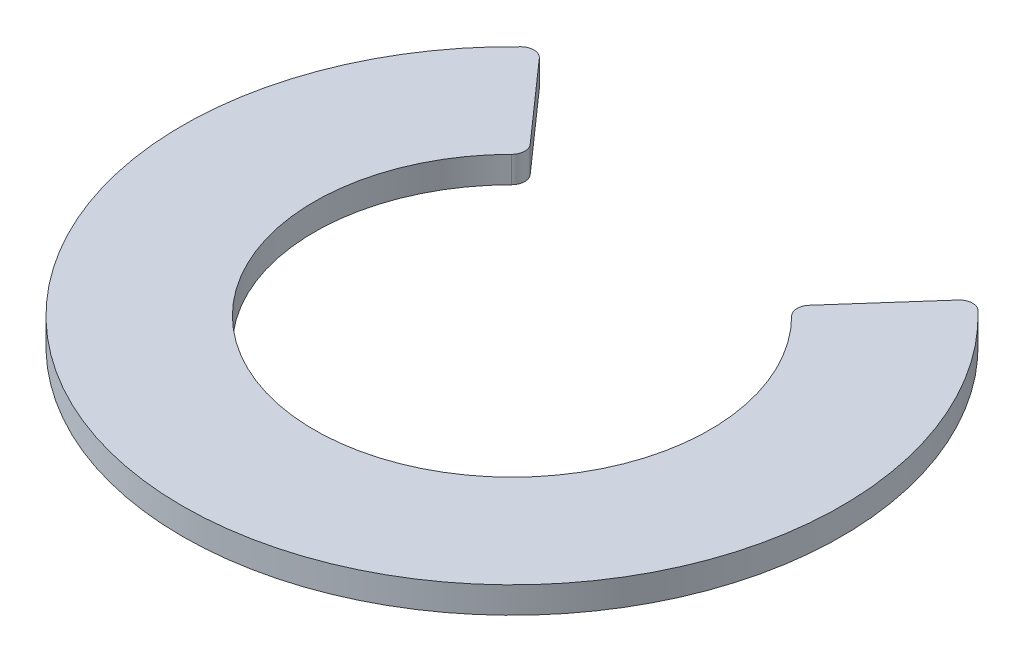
SolidWorks part; units mm, degrees
ref_plane "Front Plane" through (0, 0, 0) normal (0, 0, 1) x (1, 0, 0)
ref_plane "Top Plane" through (0, 0, 0) normal (0, 1, 0) x (1, 0, 0)
ref_plane "Right Plane" through (0, 0, 0) normal (1, 0, 0) x (0, 0, -1)
sketch "Sketch1" plane through (0, 0, 0) normal (0, 1, 0) x (1, 0, 0)
  line L0 (-1.6565, 1.8724) -> (-0.9939, 1.1235)
  line L1 (0.9939, 1.1235) -> (1.6565, 1.8724)
  line L2 (0, 0) -> (0, 0.8997) construction
  arc A0 (-0.9939, 1.1235) -> (0.9939, 1.1235) centre (0, 0) ccw
  arc A1 (-1.6565, 1.8724) -> (1.6565, 1.8724) centre (0, 0) ccw
  dimension "D1" = 3
  dimension "D2" = 5
extrude "Boss-Extrude1" add sketch "Sketch1" along normal blind 0.2
fillet "Fillet1" radius 0.1 4 edges at (0.9939, 0.1, -1.1235) (1.6565, 0.1, -1.8724) (-1.6565, 0.1, -1.8724) (-0.9939, 0.1, -1.1235)
